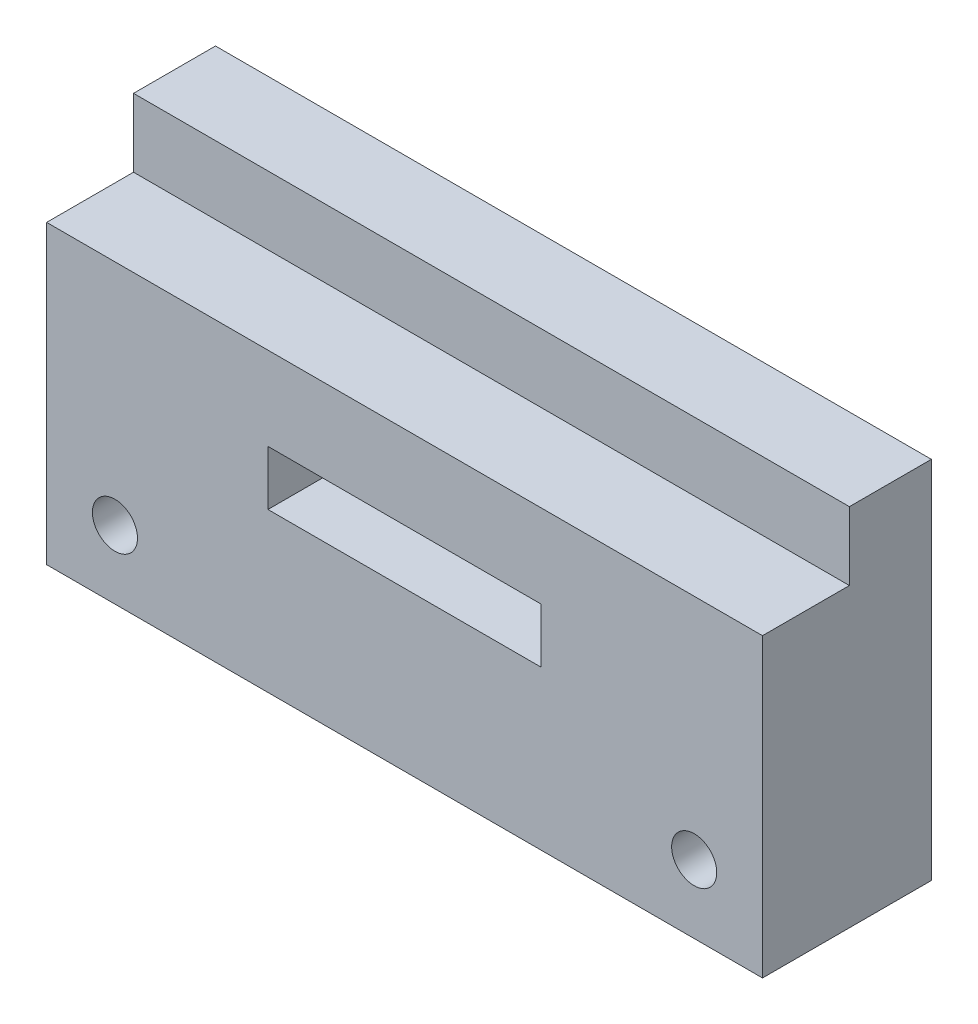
SolidWorks part; units mm, degrees
ref_plane "前视基准面" through (0, 0, 0) normal (0, 0, 1) x (1, 0, 0)
ref_plane "上视基准面" through (0, 0, 0) normal (0, 1, 0) x (1, 0, 0)
ref_plane "右视基准面" through (0, 0, 0) normal (1, 0, 0) x (0, 0, -1)
sketch "草图1" plane through (0, 0, 0) normal (0, 0, 1) x (1, 0, 0)
  line L0 (0, 0) -> (0, 26.7)
  line L1 (52.4, 0) -> (52.4, 26.7)
  line L2 (0, 0) -> (52.4, 0)
  line L3 (0, 26.7) -> (52.4, 26.7)
  line L4 (16.2, 11.6) -> (16.2, 15.6)
  line L5 (36.2, 11.6) -> (36.2, 15.6)
  line L6 (16.2, 15.6) -> (36.2, 15.6)
  line L7 (16.2, 11.6) -> (36.2, 11.6)
  circle A0 centre (5, 5) radius 1.65
  circle A1 centre (47.4, 5) radius 1.65
extrude "凸台-拉伸1" add sketch "草图1" along normal blind 12.36
sketch "草图2" plane through (52.4, 0, 0) normal (1, 0, 0) x (0, 0, -1)
  line L0 (-12.36, 0) -> (-12.36, 21.7)
  line L1 (0, 0) -> (0, 26.7)
  line L2 (-12.36, 0) -> (0, 0)
  line L3 (-12.36, 21.7) -> (-6, 21.7)
  line L4 (-6, 26.7) -> (0, 26.7)
  line L5 (-6, 21.7) -> (-6, 26.7)
extrude "切除-拉伸1" cut sketch "草图2" against normal through all flip side to cut
